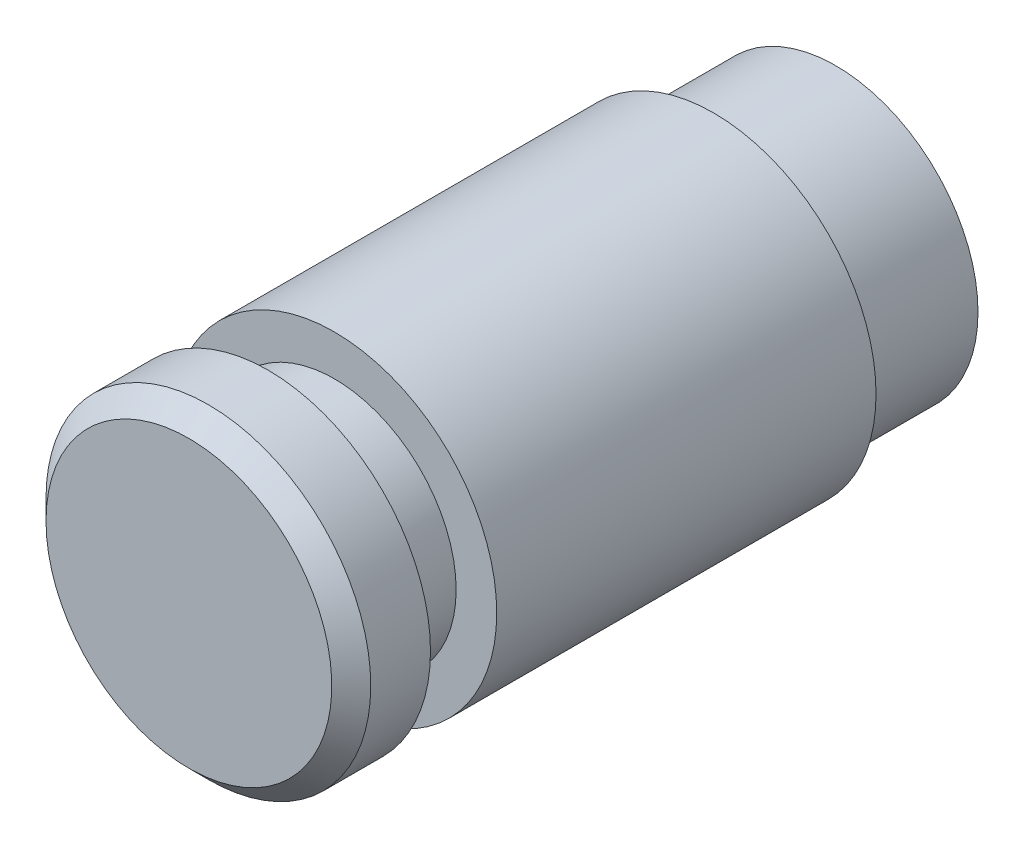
SolidWorks part; units mm, degrees
ref_plane "Front Plane" through (0, 0, 0) normal (0, 0, 1) x (1, 0, 0)
ref_plane "Top Plane" through (0, 0, 0) normal (0, 1, 0) x (1, 0, 0)
ref_plane "Right Plane" through (0, 0, 0) normal (1, 0, 0) x (0, 0, -1)
sketch "Sketch1" plane through (0, 0, 0) normal (0, 0, 1) x (1, 0, 0)
  circle A0 centre (0, 0) radius 2.7813
  dimension "D1" = 5.5626
extrude "Boss-Extrude1" add sketch "Sketch1" against normal blind 2.3876
sketch "Sketch2" plane through (0, 0, 0) normal (0, 0, 1) x (1, 0, 0)
  circle A0 centre (0, 0) radius 3.175
  dimension "D1" = 6.35
extrude "Boss-Extrude2" add sketch "Sketch2" along normal blind 10.2616
chamfer "Chamfer1" distance 0.381 angle 45 1 edges at (3.175, 0, 10.2616)
sketch "Sketch3" plane through (0, 0, 0) normal (1, 0, 0) x (0, 0, -1)
  line L0 (0, 3.175) -> (-9.8806, 3.175) construction
  line L1 (-8.7122, 3.175) -> (-7.4168, 3.175)
  line L2 (-8.7122, 3.175) -> (-8.7122, 2.3812)
  line L3 (-8.7122, 2.3812) -> (-7.4168, 2.3812)
  line L4 (-7.4168, 3.175) -> (-7.4168, 2.3812)
  line L5 (0, 0) -> (-8.2121, 0) construction
  line L6 (0, -3.175) -> (0, 3.175) construction
  dimension "D1" = 1.2954
  dimension "D2" = 4.7625
  dimension "D3" = 7.4168
revolve "Cut-Revolve1" cut sketch "Sketch3" angle 360 about L5
